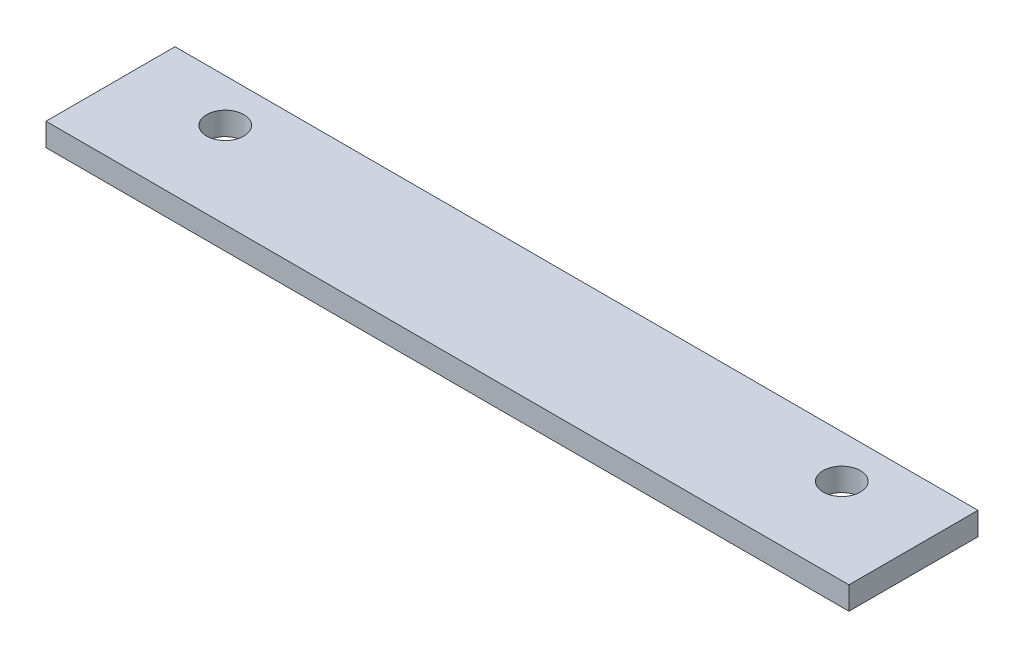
SolidWorks part; units mm, degrees
ref_plane "Front Plane" through (0, 0, 0) normal (0, 0, 1) x (1, 0, 0)
ref_plane "Top Plane" through (0, 0, 0) normal (0, 1, 0) x (1, 0, 0)
ref_plane "Right Plane" through (0, 0, 0) normal (1, 0, 0) x (0, 0, -1)
sketch "Sketch1" plane through (0, 0, 0) normal (0, 1, 0) x (1, 0, 0)
  line L0 (0, 45) -> (0, -45) construction
  line L1 (-280, -45) -> (280, -45)
  line L2 (-280, -45) -> (-280, 45)
  line L3 (-280, 45) -> (280, 45)
  line L4 (280, -45) -> (280, 45)
  line L5 (-280, -45) -> (280, 45) construction
  line L6 (-280, 45) -> (280, -45) construction
  circle A0 centre (215, 15) radius 13
  circle A1 centre (-215, 15) radius 13
  point P0 (0, 0)
  dimension "D3" = 65
  dimension "D5" = 26
  dimension "D1" = 560
  dimension "D2" = 90
  dimension "D4" = 30
extrude "Boss-Extrude1" add sketch "Sketch1" along normal blind 16
